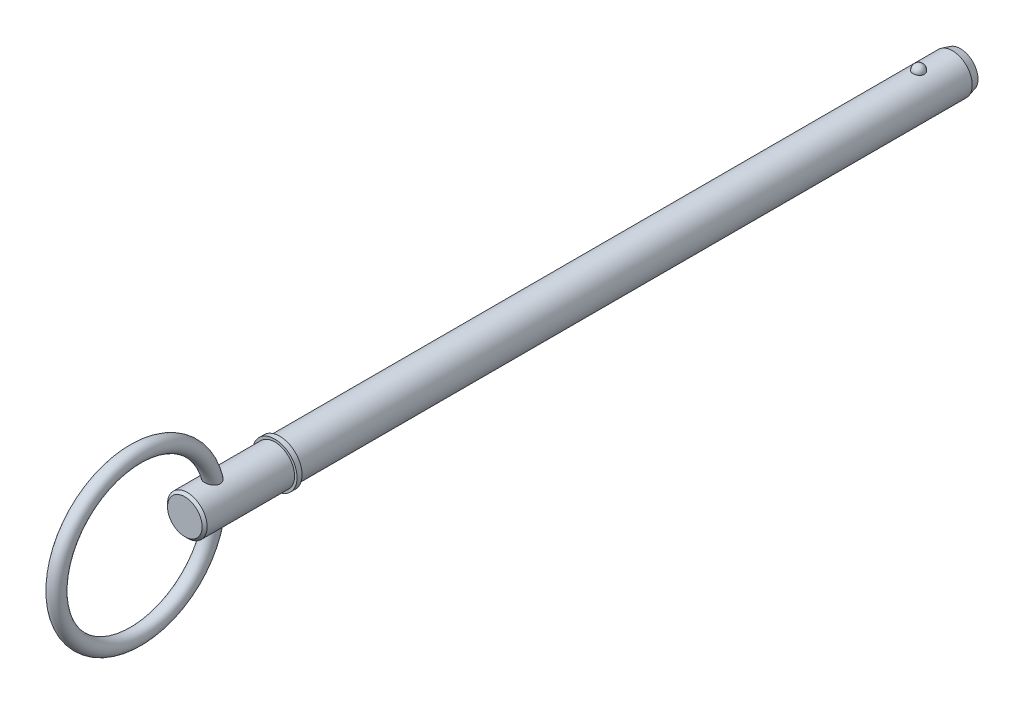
SolidWorks part; units mm, degrees
ref_plane "Front Plane" through (0, 0, 0) normal (0, 0, 1) x (1, 0, 0)
ref_plane "Top Plane" through (0, 0, 0) normal (0, 1, 0) x (1, 0, 0)
ref_plane "Right Plane" through (0, 0, 0) normal (1, 0, 0) x (0, 0, -1)
sketch "Sketch2" plane through (0, 0, 0) normal (0, 0, 1) x (1, 0, 0)
  circle A0 centre (0, 0) radius 3.97
  point P3 (0, 3.97)
  dimension "D1" = 7.94
extrude "Boss-Extrude1" add sketch "Sketch2" along normal blind 127
sketch "Sketch3" plane through (0, 0, 0) normal (0, 0, -1) x (-1, 0, 0)
  circle A0 centre (0, 0) radius 3.97
  dimension "D1" = 7.94
extrude "Boss-Extrude2" add sketch "Sketch3" along normal blind 9.53
chamfer "Chamfer1" distance 1.586 angle 15 1 edges at (-3.97, 0, -9.53)
sketch "Sketch18" plane through (0, 0, 0) normal (1, 0, 0) x (0, 0, -1)
  line L0 (7.944, 3.97) -> (-127, 3.97) construction
  line L1 (1.15, 5.12) -> (1.15, 2.82)
  line L2 (-127, -3.97) -> (7.944, -3.97) construction
  arc A0 (1.15, 5.12) -> (1.15, 2.82) centre (1.15, 3.97) ccw
  point P4 (0, 3.97)
  dimension "D1" = 9.09
revolve "Revolve1" add sketch "Sketch18" angle 360 about L1
sketch "Sketch19" plane through (0, 0, 0) normal (1, 0, 0) x (0, 0, -1)
  line L0 (-33.7288, 0) -> (-46.4542, 0) construction
sketch "Sketch20" plane through (0, 0, 0) normal (1, 0, 0) x (0, 0, -1)
  line L0 (-127, 0) -> (-127, 4.47)
  line L1 (-127, 3.97) -> (-127, -3.97) construction
  line L2 (-127, 4.47) -> (-128, 4.47)
  line L3 (-128, 4.47) -> (-128, 0)
  line L4 (-33.7288, 0) -> (-46.4542, 0) construction
  line L5 (-128, 0) -> (-127, 0)
  dimension "D1" = 4.47
  dimension "D2" = 1
revolve "Revolve2" add sketch "Sketch20" angle 360 about L0
sketch "Sketch21" plane through (0, 0, 127) normal (0, 0, -1) x (-1, 0, 0)
  circle A0 centre (0, 0) radius 3.97
  dimension "D1" = 7.94
extrude "Boss-Extrude3" add sketch "Sketch21" against normal blind 19.05
chamfer "Chamfer2" distance 0.5 angle 45 1 edges at (-3.97, 0, 146.05)
sketch "Sketch23" plane through (0, 0, 0) normal (1, 0, 0) x (0, 0, -1)
  line L0 (-146.05, 3.47) -> (-146.05, -3.47) construction
  circle A0 centre (-155.925, 0) radius 15.875
  point P2 (-140.05, 0)
  dimension "D1" = 31.75
  dimension "D2" = 6
sketch "Sketch24" plane through (0, 0, 0) normal (0, 1, 0) x (1, 0, 0)
  circle A0 centre (0, -140.05) radius 1.5
  dimension "D1" = 3
sweep "Sweep1" add profiles "Sketch24" path "Sketch23"
